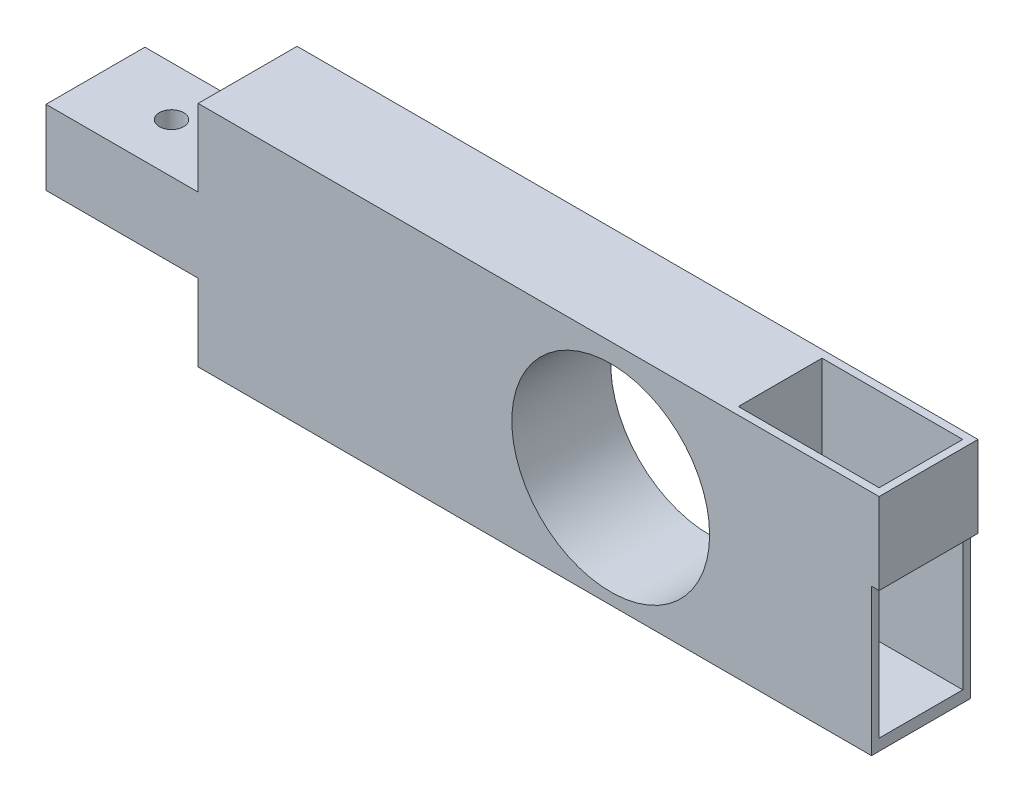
SolidWorks part; units mm, degrees
ref_plane "Front Plane" through (0, 0, 0) normal (0, 0, 1) x (1, 0, 0)
ref_plane "Top Plane" through (0, 0, 0) normal (0, 1, 0) x (1, 0, 0)
ref_plane "Right Plane" through (0, 0, 0) normal (1, 0, 0) x (0, 0, -1)
sketch "Sketch1" plane through (0, 0, 0) normal (0, 0, 1) x (1, 0, 0)
  line L1 (0, 0) -> (355.325, 0)
  line L2 (0, 0) -> (0, 30)
  line L3 (0, 30) -> (355.325, 30)
  line L4 (355.325, 0) -> (355.325, 30)
  line L5 (50, 0) -> (250, 0)
  line L6 (50, 0) -> (50, -17)
  line L7 (50, -17) -> (250, -17)
  line L8 (250, 0) -> (250, -17)
  line L9 (0, 0) -> (355.325, 0)
  line L10 (0, 0) -> (0, -17)
  line L11 (0, -17) -> (355.325, -17)
  line L12 (355.325, 0) -> (355.325, -17)
  line L13 (0, 0) -> (177.6625, 0)
  line L14 (0, 0) -> (0, -17)
  line L15 (0, -17) -> (177.6625, -17)
  line L16 (177.6625, 0) -> (177.6625, -17)
  line L17 (0, 0) -> (50, 0)
  line L18 (0, 0) -> (0, -5)
  line L19 (0, -5) -> (50, -5)
  line L20 (50, 0) -> (50, -5)
  circle A0 centre (20.775, 14.5) radius 12.5
  circle A1 centre (334.55, 14.5) radius 12.5
  circle A2 centre (60, -2.5) radius 1
  circle A3 centre (68, -2.5) radius 1
  circle A4 centre (60, -14.5) radius 1
  circle A5 centre (68, -14.5) radius 1
  dimension "D1" = 25
  dimension "D11" = 2
  dimension "D2" = 313.775
  dimension "D3" = 20.775
  dimension "D4" = 20.775
  dimension "D5" = 30
  dimension "D6" = 15.5
  dimension "D7" = 15.5
  dimension "D8" = 17
  dimension "D9" = 50
  dimension "D10" = 200
  dimension "D12" = 8
  dimension "D13" = 12
  dimension "D14" = 8
  dimension "D15" = 12
  dimension "D16" = 10
  dimension "D17" = 10
  dimension "D18" = 2.5
  dimension "D19" = 2.5
  dimension "D20" = 5
extrude "Boss-Extrude3" add sketch "Sketch1" along normal blind 13 contours L1 L9 L4 L3 L2 A1 A0 | L16 L1 L6 L7 A5 A4 A3 A2 | L10 L19 L6 L1
fillet "Fillet3" radius 5 6 edges at (355.325, 0, 6.5) (355.325, 30, 6.5) (177.6625, -17, 6.5) (50, -17, 6.5) (0, -5, 6.5) (0, 30, 6.5)
sketch "Sketch3" plane through (0, 0, 13) normal (0, 0, 1) x (1, 0, 0)
  line L0 (0, 0) -> (0, 25) construction
  circle A0 centre (85, 14.5) radius 12.5
  circle A1 centre (165, 14.5) radius 12.5
  circle A2 centre (245, 14.5) radius 12.5
  dimension "D1" = 25
  dimension "D2" = 85
  dimension "D3" = 80
  dimension "D4" = 80
extrude "Boss-Extrude4" add sketch "Sketch3" along normal blind 13
sketch "Sketch4" plane through (0, 0, 0) normal (0, 0, -1) x (-1, 0, 0)
  circle A0 centre (-68, -2.5) radius 1.425
  circle A1 centre (-60, -2.5) radius 1.425
  circle A2 centre (-60, -14.5) radius 1.425
  circle A3 centre (-68, -14.5) radius 1.425
  dimension "D1" = 2.85
extrude "Cut-Extrude1" cut sketch "Sketch4" against normal up to next
sketch "Sketch5" plane through (0, 0, 0) normal (0, 0, -1) x (-1, 0, 0)
  line L1 (-177.6625, 0) -> (-113.8325, 0)
  line L2 (-177.6625, 0) -> (-177.6625, -18)
  line L3 (-177.6625, -18) -> (-113.8325, -18)
  line L4 (-113.8325, 0) -> (-113.8325, -18)
  dimension "D1" = 63.83
  dimension "D2" = 18
extrude "Cut-Extrude3" cut sketch "Sketch5" against normal through all
fillet "Fillet4" radius 5 1 edges at (113.8325, -17, 6.5)
sketch "Sketch6" plane through (0, 0, 13) normal (0, 0, 1) x (1, 0, 0)
  line L1 (50, 0) -> (113.8325, 0)
  line L2 (50, 0) -> (50, -17)
  line L3 (50, -17) -> (113.8325, -17)
  line L4 (113.8325, 0) -> (113.8325, -17)
extrude "Cut-Extrude4" cut sketch "Sketch6" against normal blind 5
sketch "Sketch7" plane through (0, 0, 8) normal (0, 0, 1) x (1, 0, 0)
  circle A0 centre (60, -2.5) radius 1
  circle A1 centre (68, -2.5) radius 1
  circle A2 centre (68, -14.5) radius 1
  circle A3 centre (60, -14.5) radius 1
  circle A4 centre (60, -14.5) radius 2.1596
  circle A5 centre (60, -2.5) radius 2.1171
  circle A6 centre (68, -2.5) radius 1.9161
  circle A7 centre (68, -14.5) radius 2.4159
  dimension "D1" = 2
extrude "Boss-Extrude5" add sketch "Sketch7" against normal blind 8
sketch "Sketch8" plane through (0, 0, 26) normal (0, 0, 1) x (1, 0, 0)
  circle A0 centre (85, 14.5) radius 12.5
  circle A1 centre (165, 14.5) radius 12.5
  circle A2 centre (245, 14.5) radius 12.5
extrude "Boss-Extrude6" add sketch "Sketch8" along normal blind 13
sketch "Sketch10" plane through (0, 0, 13) normal (0, 0, 1) x (1, 0, 0)
  line L0 (50, 0) -> (350.325, 0) construction
  line L4 (285.325, 30) -> (285.325, 19.9)
  line L5 (5, 30) -> (350.325, 30) construction
  line L6 (285.325, 19.9) -> (265.325, 19.9)
  line L8 (285.325, 10.1) -> (265.325, 10.1)
  line L9 (265.325, 19.9) -> (265.325, 10.1)
  line L11 (55, -17) -> (108.8325, -17) construction
  line L12 (113.8325, -12) -> (113.8325, 0) construction
  line L13 (113.8325, 0) -> (50, 0) construction
  line L14 (50, 0) -> (50, -5) construction
  line L15 (50, -5) -> (50, -12) construction
  line L16 (50, -5) -> (50, 0) construction
  line L17 (350.325, 30) -> (5, 30) construction
  line L18 (0, 25) -> (0, 0) construction
  line L19 (5, -5) -> (50, -5) construction
  line L20 (55, -17) -> (108.8325, -17)
  line L21 (113.8325, -12) -> (113.8325, 0)
  line L22 (113.8325, 0) -> (50, 0)
  line L23 (50, 0) -> (50, -5)
  line L24 (50, -5) -> (50, -12)
  line L25 (50, -5) -> (50, 0)
  line L26 (50, 0) -> (285.325, 0)
  line L28 (285.325, 30) -> (5, 30)
  line L29 (0, 25) -> (0, 0)
  line L30 (5, -5) -> (50, -5)
  line L31 (285.325, 10.1) -> (285.325, 0)
  arc A0 (108.8325, -17) -> (113.8325, -12) centre (108.8325, -12) ccw construction
  arc A1 (50, -12) -> (55, -17) centre (55, -12) ccw construction
  circle A2 centre (334.55, 14.5) radius 13
  arc A4 (5, 30) -> (0, 25) centre (5, 25) ccw construction
  arc A5 (0, 0) -> (5, -5) centre (5, 0) ccw construction
  arc A6 (108.8325, -17) -> (113.8325, -12) centre (108.8325, -12) ccw
  arc A7 (50, -12) -> (55, -17) centre (55, -12) ccw
  arc A10 (5, 30) -> (0, 25) centre (5, 25) ccw
  arc A11 (0, 0) -> (5, -5) centre (5, 0) ccw
  dimension "D1" = 26
  dimension "D2" = 20
  dimension "D3" = 9.8
  dimension "D4" = 10.1
extrude "Cut-Extrude5" cut sketch "Sketch10" against normal through all and the other way through all contours L31 L8 L9 L6 L4 M9 M10 M11 M12 M13 M4 M5 M14 M16 M18 M15 | A2 M17 | M16 | M15 | M14 | L24 A7 L20 A6 L21 M5 M4
sketch "Sketch13" plane through (285.325, 0, 0) normal (-1, 0, 0) x (0, 0, 1)
  line L1 (0, 30) -> (13, 30)
  line L2 (0, 30) -> (0, 0)
  line L3 (0, 0) -> (13, 0)
  line L4 (13, 30) -> (13, 0)
extrude "Boss-Extrude7" add sketch "Sketch13" along normal blind 5
sketch "Sketch14" plane through (265.325, 0, 0) normal (-1, 0, 0) x (0, 0, 1)
  line L1 (0, 19.9) -> (13, 19.9)
  line L2 (0, 19.9) -> (0, 10.1)
  line L3 (0, 10.1) -> (13, 10.1)
  line L4 (13, 19.9) -> (13, 10.1)
extrude "Boss-Extrude8" add sketch "Sketch14" along normal blind 5
sketch "Sketch15" plane through (0, 19.9, 0) normal (0, 1, 0) x (1, 0, 0)
  line L0 (280.325, 0) -> (260.325, 0) construction
  line L1 (260.325, -13) -> (260.325, 0) construction
  circle A0 centre (270.325, -6.5) radius 1.6
  dimension "D1" = 3.2
  dimension "D2" = 6.5
  dimension "D3" = 10
extrude "Cut-Extrude6" cut sketch "Sketch15" against normal through all
sketch "Sketch17" plane through (0, 0, 13) normal (0, 0, 1) x (1, 0, 0)
  line L1 (350.325, 30) -> (355.325, 30)
  line L2 (350.325, 30) -> (350.325, 0)
  line L3 (350.325, 0) -> (355.325, 0)
  line L4 (355.325, 30) -> (355.325, 0)
  dimension "D1" = 5
  dimension "D2" = 30
extrude "Cut-Extrude7" cut sketch "Sketch17" against normal through all
sketch "Sketch18" plane through (350.325, 0, 0) normal (1, 0, 0) x (0, 0, -1)
  line L1 (0, 30) -> (0, 0) construction
  line L3 (-11.25, 30) -> (-11.25, 1.5)
  line L4 (-11.25, 1.5) -> (-1.75, 1.5)
  line L5 (-1.75, 30) -> (-1.75, 1.5)
  line L6 (0, 0) -> (-13, 0) construction
  line L8 (-11.25, 30) -> (-13, 30)
  line L9 (-13, 30) -> (-13, 0)
  line L10 (-13, 0) -> (0, 0)
  line L11 (0, 0) -> (0, 30)
  line L12 (0, 30) -> (-1.75, 30)
  dimension "D1" = 9.5
  dimension "D2" = 1.75
  dimension "D3" = 1.5
extrude "Boss-Extrude9" add sketch "Sketch18" along normal blind 18.5
sketch "Sketch19" plane through (368.825, 0, 0) normal (1, 0, 0) x (0, 0, -1)
  line L0 (0, 0) -> (0, 30) construction
  line L1 (-13, 30) -> (0, 30)
  line L2 (-13, 30) -> (-13, 19.3)
  line L3 (-13, 19.3) -> (0, 19.3)
  line L4 (0, 30) -> (0, 19.3)
  line L5 (-13, 0) -> (0, 0) construction
  dimension "D1" = 19.3
extrude "Boss-Extrude10" add sketch "Sketch19" along normal blind 1
sketch "Sketch20" plane through (0, 30, 0) normal (0, 1, 0) x (1, 0, 0)
  line L0 (368.825, -1.75) -> (368.825, -11.25) construction
  line L1 (350.325, -1.75) -> (368.825, -1.75)
  line L2 (350.325, -1.75) -> (350.325, -1)
  line L3 (350.325, -1) -> (368.825, -1)
  line L4 (368.825, -1.75) -> (368.825, -1)
  line L5 (350.325, -11.25) -> (368.827, -11.25)
  line L6 (350.325, -11.25) -> (350.325, -12)
  line L7 (350.325, -12) -> (368.827, -12)
  line L8 (368.827, -11.25) -> (368.827, -12)
  dimension "D1" = 0.75
  dimension "D2" = 0.75
extrude "Cut-Extrude8" cut sketch "Sketch20" against normal up to surface (28.5 mm away)
